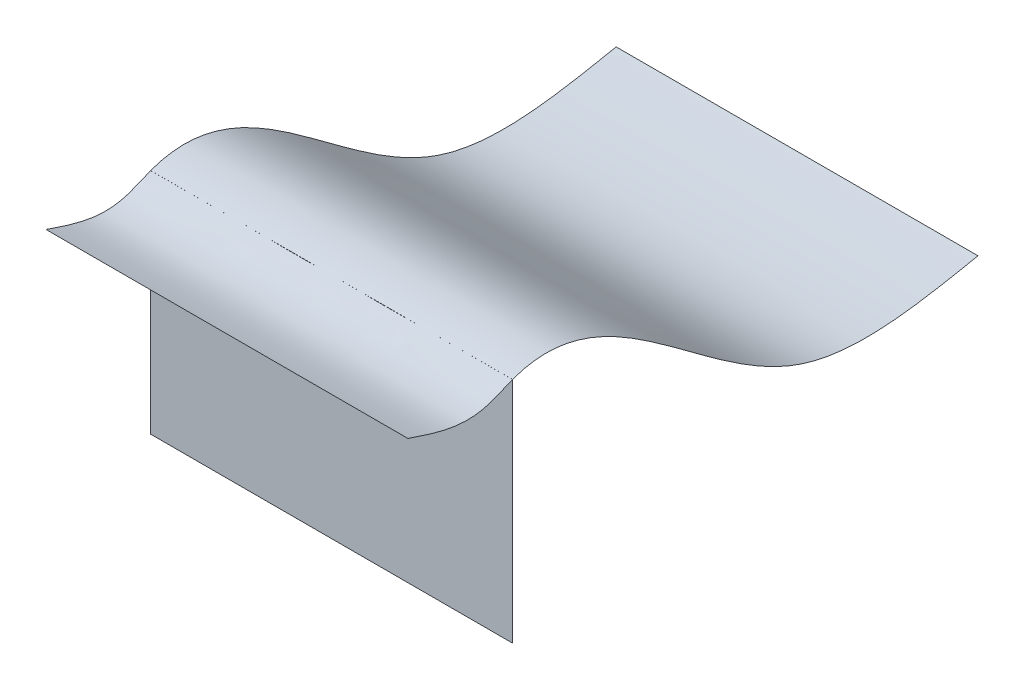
SolidWorks part; units mm, degrees
ref_plane "Front Plane" through (0, 0, 0) normal (0, 0, 1) x (1, 0, 0)
ref_plane "Top Plane" through (0, 0, 0) normal (0, 1, 0) x (1, 0, 0)
ref_plane "Right Plane" through (0, 0, 0) normal (1, 0, 0) x (0, 0, -1)
sketch "Sketch1" plane through (0, 0, 0) normal (0, 1, 0) x (1, 0, 0)
  line L0 (0, 0) -> (105.0676, 0)
surface "Surface-Extrude1" sketch "Sketch1" parameters "D1"=66.294
sketch "Sketch2" plane through (0, 0, 0) normal (1, 0, 0) x (0, 0, -1)
  spline S0 degree 3 poles (-30.3862, 66.6664) (-22.6224, 63.9922) (-12.1253, 60.3764) (25.8676, 80.0892) (68.8682, 16.5864) (117.6028, 26.3205) (135.1408, 29.8235) knots 0 0 0 0 0.132105 0.178611 0.704409 1 1 1 1
surface "Surface-Extrude2" sketch "Sketch2"
sketch "Sketch3" plane through (0, 0, 0) normal (0, 1, 0) x (1, 0, 0)
  line L0 (0, 0) -> (0, 54.2654)
  line L1 (105.0676, 54.2654) -> (105.0676, 0)
  line L2 (0, 0) -> (105.0676, 0) construction
  arc A0 (0, 54.2654) -> (105.0676, 54.2654) centre (52.5338, 54.2654) cw
